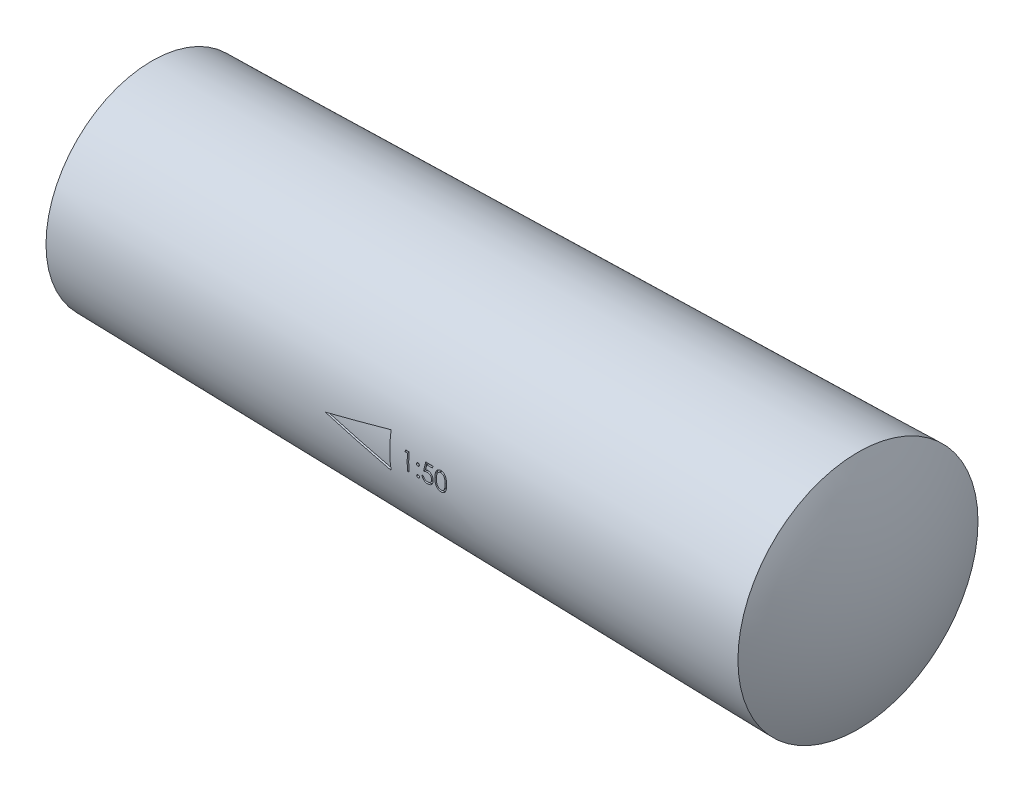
SolidWorks part; units mm, degrees
ref_plane "Front Plane" through (0, 0, 0) normal (0, 0, 1) x (1, 0, 0)
ref_plane "Top Plane" through (0, 0, 0) normal (0, 1, 0) x (1, 0, 0)
ref_plane "Right Plane" through (0, 0, 0) normal (1, 0, 0) x (0, 0, -1)
sketch "Sketch1" plane through (0, 0, 0) normal (1, 0, 0) x (0, 0, -1)
  circle A0 centre (0, 0) radius 6
  dimension "D1" = 12
extrude "Extrude1" add sketch "Sketch1" along normal mid plane 40
draft "Draft1" type of draft neutral plane draft angle 1.146 faces to draft 1 parameters "D1"=1.146
sketch "Sketch2" plane through (0, 0, 0) normal (0, 0, 1) x (1, 0, 0)
  line L0 (-20, 0) -> (-20, 6)
  line L1 (-20, 6) -> (-20, -6) construction
  line L2 (-20, 0) -> (-21.6, 0)
  line L3 (-21.6, 0) -> (-21.6, -6.4) construction
  line L4 (20, 0) -> (20, 6.8)
  line L5 (20, -6.8) -> (20, 6.8) construction
  line L6 (20, 0) -> (21.6, 0)
  line L7 (21.6, 0) -> (21.6, -6.4) construction
  line L8 (-20, -6) -> (20, -6.8) construction
  arc A0 (-21.6, 0) -> (-20, 6) centre (-9.55, 0) cw
  arc A1 (21.6, 0) -> (20, 6.8) centre (6.3499, 0) ccw
  point P14 (0, -6.4)
revolve "Revolve1" add sketch "Sketch2" angle 360 about L2
sketch "Sketch5" plane through (0, 0, 0) normal (0, 0, 1) x (1, 0, 0)
  line L0 (0, 6.4) -> (0, -6.4) construction
  line L1 (20, 6.8) -> (-20, 6) construction
  line L2 (-20, -6) -> (20, -6.8) construction
ref_plane "Plane2" through (0, 0, 0) normal (-0.02, 0, 0.9998) x (0.9998, 0, 0.02)
sketch "Sketch6" plane through (0, 0, 0) normal (-0.02, 0, 0.9998) x (0.9998, 0, 0.02)
  line L0 (0, 0) -> (0, 1)
  line L1 (0, 6.4) -> (0, -6.4) construction
  line L2 (0, 1) -> (-3.7321, 0)
  line L3 (-3.7321, 0) -> (0, -1)
  line L4 (0, -1) -> (0, 0)
  line L5 (0, -0.5) -> (4, -0.5) construction
  text T0 "1:50" font "Century Gothic" height 1
  dimension "D1" = 2
  dimension "D2" = 30
  dimension "D3" = 4
wrap "Wrap2" sketch "Sketch6" wrap type deboss source sketch "Sketch6" thickness 0.1 parameters "D1"=0.1
equation "\"D2@Sketch2\" = \"D1@Sketch2\""
